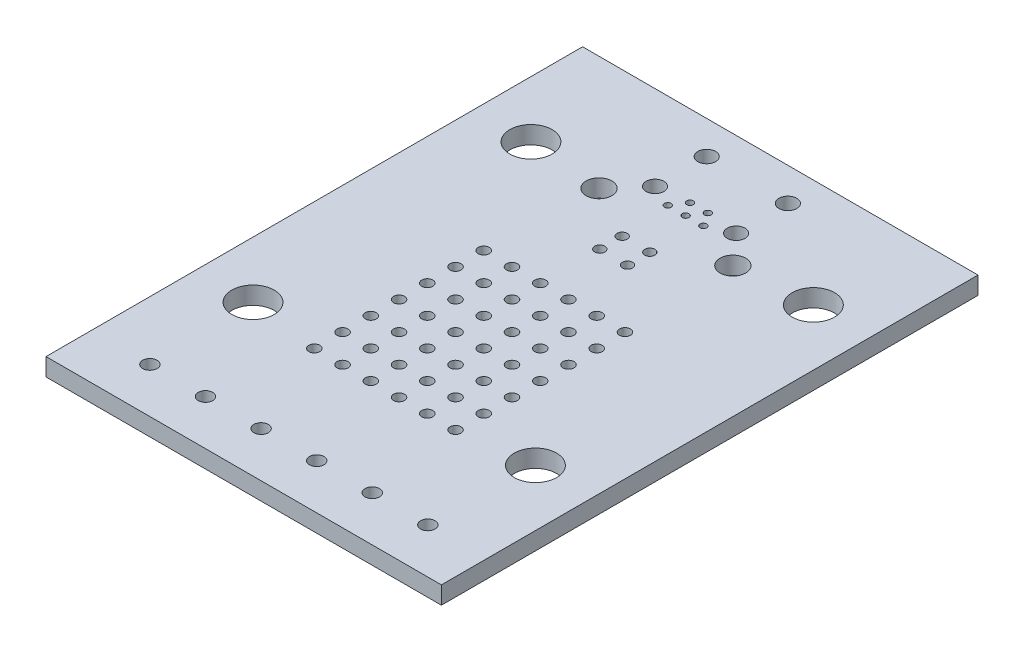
SolidWorks part; units mm, degrees
ref_plane "Front Plane" through (0, 0, 0) normal (0, 0, 1) x (1, 0, 0)
ref_plane "Top Plane" through (0, 0, 0) normal (0, 1, 0) x (1, 0, 0)
ref_plane "Right Plane" through (0, 0, 0) normal (1, 0, 0) x (0, 0, -1)
sketch "Sketch1" plane through (0, 0, 0) normal (0, 1, 0) x (1, 0, 0)
  line L1 (-17.78, 48.26) -> (17.78, 48.26)
  line L2 (-17.78, 48.26) -> (-17.78, 0)
  line L3 (-17.78, 0) -> (17.78, 0)
  line L4 (17.78, 48.26) -> (17.78, 0)
  point P4 (0, 0)
  dimension "D1" = 35.56
  dimension "D2" = 48.26
extrude "Boss-Extrude1" add sketch "Sketch1" along normal blind 1.5875
sketch "Sketch2"
  line L0 (-17.78, 0) -> (17.78, 0) construction
  line L1 (0, 0) -> (0, 48.26) construction
  line L2 (17.78, 48.26) -> (-17.78, 48.26) construction
  circle A0 centre (-12.7, 13.5382) radius 1.905
  circle A1 centre (-12.7, 38.5343) radius 1.905
  circle A2 centre (-12.4993, 4.064) radius 0.65
  circle A3 centre (-7.5006, 4.064) radius 0.65
  circle A4 centre (-2.4994, 4.064) radius 0.65
  circle A5 centre (12.7, 38.5343) radius 1.905
  circle A6 centre (12.7, 13.5382) radius 1.905
  circle A7 centre (2.4994, 4.064) radius 0.65
  circle A8 centre (7.5006, 4.064) radius 0.65
  circle A9 centre (12.4993, 4.064) radius 0.65
other "AlignGroup1" parameters "D1"=2.9209, "D2"=2.4096, "D3"=0, "D4"=4.064, "D5"=13.5382, "D6"=38.5343, "D7"=0, "D8"=2.4994, "D9"=7.5006, "D10"=12.4993, "D11"=12.7
other "AlignGroup2"
extrude "Cut-Extrude1" cut sketch "Sketch2" against normal through all
sketch "Sketch3" plane through (0, 1.5875, 0) normal (0, 1, 0) x (1, 0, 0)
  line L0 (-17.78, 0) -> (17.78, 0) construction
  line L1 (-6.35, 12.7) -> (-3.81, 12.7) construction
  line L2 (-6.35, 12.7) -> (-6.35, 15.24) construction
  circle A0 centre (-6.35, 12.7) radius 0.4953
  circle A1 centre (-3.81, 12.7) radius 0.4953
  circle A2 centre (-1.27, 12.7) radius 0.4953
  circle A3 centre (1.27, 12.7) radius 0.4953
  circle A4 centre (3.81, 12.7) radius 0.4953
  circle A5 centre (6.35, 12.7) radius 0.4953
  circle A6 centre (-3.81, 15.24) radius 0.4953
  circle A7 centre (-1.27, 15.24) radius 0.4953
  circle A8 centre (1.27, 15.24) radius 0.4953
  circle A9 centre (3.81, 15.24) radius 0.4953
  circle A10 centre (6.35, 15.24) radius 0.4953
  circle A11 centre (-3.81, 17.78) radius 0.4953
  circle A12 centre (-1.27, 17.78) radius 0.4953
  circle A13 centre (1.27, 17.78) radius 0.4953
  circle A14 centre (3.81, 17.78) radius 0.4953
  circle A15 centre (6.35, 17.78) radius 0.4953
  circle A16 centre (-3.81, 20.32) radius 0.4953
  circle A17 centre (-1.27, 20.32) radius 0.4953
  circle A18 centre (1.27, 20.32) radius 0.4953
  circle A19 centre (3.81, 20.32) radius 0.4953
  circle A20 centre (6.35, 20.32) radius 0.4953
  circle A21 centre (-3.81, 22.86) radius 0.4953
  circle A22 centre (-1.27, 22.86) radius 0.4953
  circle A23 centre (1.27, 22.86) radius 0.4953
  circle A24 centre (3.81, 22.86) radius 0.4953
  circle A25 centre (6.35, 22.86) radius 0.4953
  circle A26 centre (-3.81, 25.4) radius 0.4953
  circle A27 centre (-1.27, 25.4) radius 0.4953
  circle A28 centre (1.27, 25.4) radius 0.4953
  circle A29 centre (3.81, 25.4) radius 0.4953
  circle A30 centre (6.35, 25.4) radius 0.4953
  circle A31 centre (-3.81, 27.94) radius 0.4953
  circle A32 centre (-1.27, 27.94) radius 0.4953
  circle A33 centre (1.27, 27.94) radius 0.4953
  circle A34 centre (3.81, 27.94) radius 0.4953
  circle A35 centre (6.35, 27.94) radius 0.4953
  circle A36 centre (-6.35, 15.24) radius 0.4953
  circle A37 centre (-6.35, 17.78) radius 0.4953
  circle A38 centre (-6.35, 20.32) radius 0.4953
  circle A39 centre (-6.35, 22.86) radius 0.4953
  circle A40 centre (-6.35, 25.4) radius 0.4953
  circle A41 centre (-6.35, 27.94) radius 0.4953
  dimension "D1" = 0.9906
  dimension "D3" = 12.7
  dimension "D2" = 6.35
  dimension "D6" = 2.54
  dimension "D7" = 2.54
  dimension "D4" = 6
  dimension "D5" = 7
extrude "Cut-Extrude2" cut sketch "Sketch3" against normal through all
sketch "Sketch4" plane through (0, 1.5875, 0) normal (0, 1, 0) x (1, 0, 0)
  line L0 (0, 48.26) -> (0, 0) construction
  line L1 (17.78, 48.26) -> (-17.78, 48.26) construction
  line L2 (-17.78, 0) -> (17.78, 0) construction
  circle A0 centre (-1.2446, 33.274) radius 0.4572
  circle A1 centre (-1.2446, 35.2806) radius 0.4572
  circle A2 centre (-6.0198, 37.973) radius 1.1557
  circle A3 centre (1.2446, 33.274) radius 0.4572
  circle A4 centre (1.2446, 35.2806) radius 0.4572
  circle A5 centre (6.0198, 37.973) radius 1.1557
  circle A6 centre (-3.65, 40.64) radius 0.8
  circle A7 centre (-3.65, 45.2907) radius 0.8
  circle A8 centre (-1.6002, 39.7408) radius 0.3
  circle A9 centre (0, 39.7408) radius 0.3
  circle A10 centre (-0.8001, 40.9397) radius 0.3
  circle A11 centre (3.65, 45.2907) radius 0.8
  circle A12 centre (3.65, 40.64) radius 0.8
  circle A13 centre (0.8001, 40.9397) radius 0.3
  circle A14 centre (1.6002, 39.7408) radius 0.3
other "AlignGroup3" parameters "D1"=1.2225, "D2"=2.2199, "D3"=2.3114, "D4"=2.3114, "D5"=0.9144, "D7"=0.9144, "D8"=0.9031, "D9"=0.7981, "D16"=0.6, "D17"=1.6, "D6"=35.56, "D10"=0, "D11"=39.7408, "D12"=40.64, "D13"=40.9397, "D14"=45.2907, "D15"=48.26
extrude "Cut-Extrude3" cut sketch "Sketch4" against normal through all
